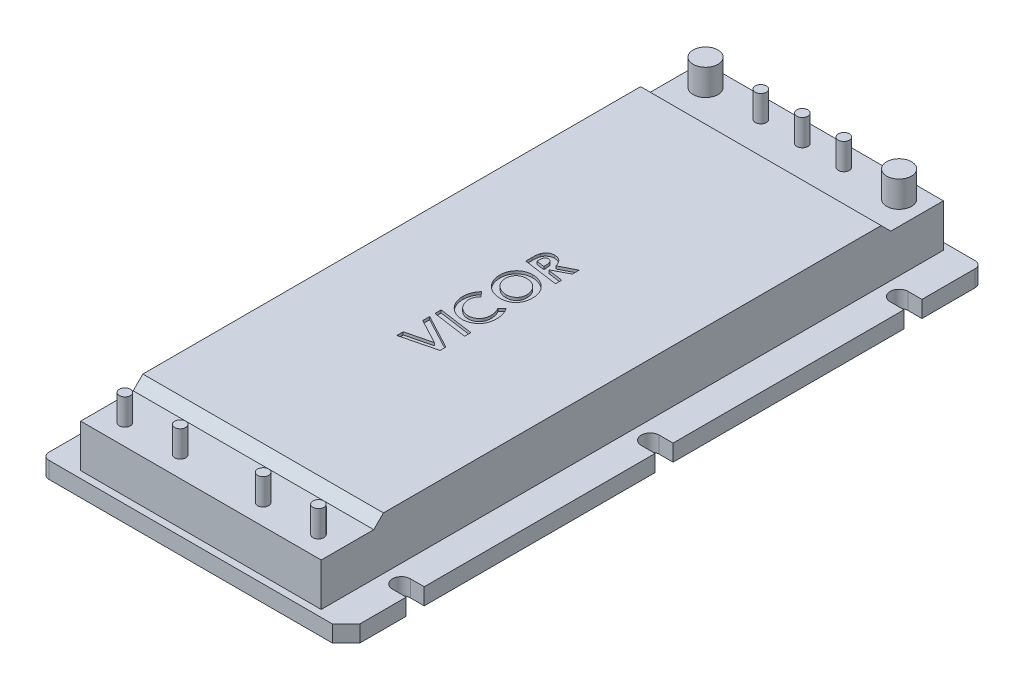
SolidWorks part; units mm, degrees
ref_plane "Front Plane" through (0, 0, 0) normal (0, 0, 1) x (1, 0, 0)
ref_plane "Top Plane" through (0, 0, 0) normal (0, 1, 0) x (1, 0, 0)
ref_plane "Right Plane" through (0, 0, 0) normal (1, 0, 0) x (0, 0, -1)
sketch "Sketch1" plane through (0, 0, 0) normal (0, 1, 0) x (1, 0, 0)
  line L1 (-55.88, 116.84) -> (0, 116.84)
  line L2 (-55.88, 116.84) -> (-55.88, 0)
  line L3 (-55.88, 0) -> (0, 0)
  line L4 (0, 116.84) -> (0, 0)
  dimension "D1" = 116.84
  dimension "D2" = 55.88
extrude "Extrude1" add sketch "Sketch1" along normal blind 3.048
sketch "Sketch2" plane through (0, 3.048, 0) normal (0, 1, 0) x (-1, 0, 0)
  line L0 (0, 0) -> (0, -116.84) construction
  line L1 (5.842, -1.27) -> (50.038, -1.27)
  line L2 (5.842, -1.27) -> (5.842, -115.57)
  line L3 (5.842, -115.57) -> (50.038, -115.57)
  line L4 (50.038, -1.27) -> (50.038, -115.57)
  line L5 (55.88, 0) -> (0, 0) construction
  dimension "D1" = 114.3
  dimension "D2" = 44.196
  dimension "D3" = 5.842
  dimension "D4" = 1.27
extrude "Extrude2" add sketch "Sketch2" along normal blind 9.652
sketch "Sketch4" plane through (0, 3.048, 0) normal (0, 1, 0) x (-1, 0, 0)
  line L0 (2.54, -56.769) -> (0, -56.769)
  line L1 (0, 0) -> (0, -116.84) construction
  line L2 (0, -56.769) -> (0, -60.071)
  line L3 (2.54, -11.049) -> (0, -11.049)
  line L4 (0, -11.049) -> (0, -14.351)
  line L5 (0, -14.351) -> (2.54, -14.351)
  line L6 (0, -60.071) -> (2.54, -60.071)
  arc A0 (2.54, -14.351) -> (2.54, -11.049) centre (2.54, -12.7) ccw
  arc A1 (2.54, -60.071) -> (2.54, -56.769) centre (2.54, -58.42) ccw
  dimension "D1" = 2.54
  dimension "D2" = 2.54
  dimension "D3" = 45.72
extrude "Cut-Extrude1" cut sketch "Sketch4" against normal through all
ref_plane "Plane1" through (-27.94, 0, 0) normal (-1, 0, 0) x (0, 0, 1)
ref_plane "Plane2" through (0, 0, -58.42) normal (0, 0, -1) x (-1, 0, 0)
mirror "Mirror1" about plane through (0, 0, -58.42) normal (0, 0, -1) of "Cut-Extrude1"
mirror "Mirror3" about plane through (-27.94, 0, 0) normal (-1, 0, 0) of "Mirror1", "Cut-Extrude1"
chamfer "Chamfer1" distance 2.54 angle 45 1 edges at (0, 1.524, 0)
fillet "Fillet1" radius 1.27 3 edges at (0, 1.524, -116.84) (-55.88, 1.524, -116.84) (-55.88, 1.524, 0)
sketch "Sketch5" plane through (0, 0, 0) normal (1, 0, 0) x (0, 0, -1)
  line L0 (115.57, 10.922) -> (105.918, 10.922)
  line L1 (105.918, 10.922) -> (104.14, 12.7)
  line L2 (1.27, 12.7) -> (115.57, 12.7) construction
  line L3 (104.14, 12.7) -> (115.57, 12.7)
  line L4 (115.57, 12.7) -> (115.57, 10.922)
  line L6 (1.27, 10.922) -> (10.922, 10.922)
  line L7 (1.27, 12.7) -> (1.27, 3.048) construction
  line L8 (10.922, 10.922) -> (12.7, 12.7)
  line L9 (12.7, 12.7) -> (1.27, 12.7)
  line L10 (1.27, 12.7) -> (1.27, 10.922)
  line L11 (105.791, 0) -> (115.57, 0) construction
  line L12 (115.57, 12.7) -> (115.57, 3.048) construction
  dimension "D1" = 10.922
  dimension "D2" = 45
  dimension "D3" = 9.652
  dimension "D4" = 9.652
extrude "Cut-Extrude2" cut sketch "Sketch5" against normal through all
sketch "Sketch6" plane through (0, 10.922, 0) normal (0, 1, 0) x (-1, 0, 0)
  circle A0 centre (10.16, -5.08) radius 1.016
  circle A1 centre (20.32, -5.08) radius 1.016
  circle A2 centre (35.56, -5.08) radius 1.016
  circle A3 centre (45.72, -5.08) radius 1.016
  circle A4 centre (10.16, -111.76) radius 2.286
  circle A5 centre (20.32, -111.76) radius 1.016
  circle A6 centre (27.94, -111.76) radius 1.016
  circle A7 centre (35.56, -111.76) radius 1.016
  circle A8 centre (45.72, -111.76) radius 2.286
  arc A9 (2.54, -14.351) -> (2.54, -11.049) centre (2.54, -12.7) ccw construction
  dimension "D1" = 7.62
  dimension "D2" = 10.16
  dimension "D3" = 17.78
  dimension "D4" = 25.4
  dimension "D5" = 35.56
  dimension "D6" = 2.032
  dimension "D7" = 4.572
  dimension "D8" = 7.62
  dimension "D9" = 106.68
extrude "Extrude4" add sketch "Sketch6" along normal offset from surface (4.826 mm away) 15.748
sketch "Sketch7" plane through (0, 12.7, 0) normal (0, 1, 0) x (-1, 0, 0)
  line L0 (26.488, -36.4153) -> (26.488, -75.1005) construction
  text T0 "VICOR" font "Century Gothic" height in points 24
extrude "Cut-Extrude3" cut sketch "Sketch7" against normal blind 0.508
